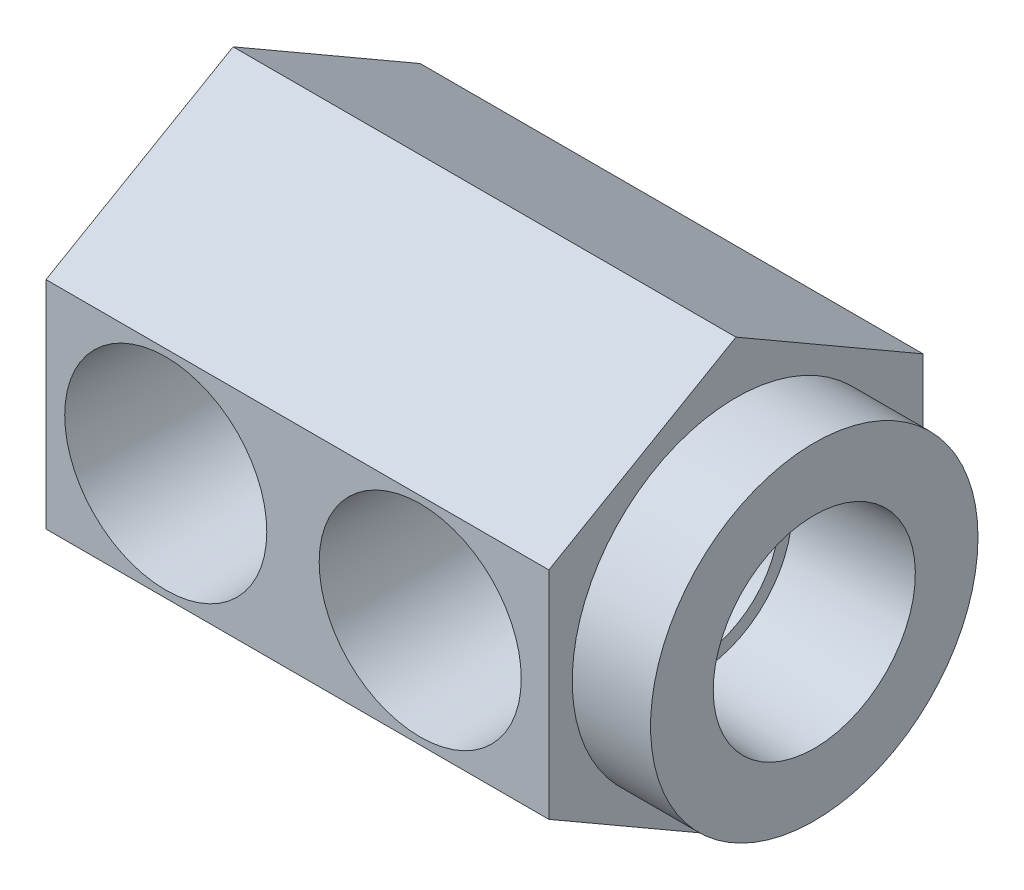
SolidWorks part; units mm, degrees
ref_plane "Front Plane" through (0, 0, 0) normal (0, 0, 1) x (1, 0, 0)
ref_plane "Top Plane" through (0, 0, 0) normal (0, 1, 0) x (1, 0, 0)
ref_plane "Right Plane" through (0, 0, 0) normal (1, 0, 0) x (0, 0, -1)
sketch "Sketch2" plane through (0, 0, 0) normal (1, 0, 0) x (0, 0, -1)
  line L0 (0, 16.1312) -> (0, -16.1312) construction
  line L1 (-12.7, -7.3323) -> (0, -14.6647)
  line L2 (0, -14.6647) -> (12.7, -7.3323)
  line L3 (12.7, -7.3323) -> (12.7, 7.3323)
  line L4 (12.7, 7.3323) -> (0, 14.6647)
  line L5 (0, 14.6647) -> (-12.7, 7.3323)
  line L6 (-12.7, 7.3323) -> (-12.7, -7.3323)
  circle A0 centre (0, 0) radius 12.7 construction
  dimension "D1" = 25.4
extrude "Boss-Extrude1" add sketch "Sketch2" along normal blind 34.1313 separate body
sketch "Sketch3" plane through (34.1313, 0, 0) normal (1, 0, 0) x (0, 0, -1)
  circle A1 centre (0, 0) radius 11.1125
  dimension "D1" = 22.225
extrude "Boss-Extrude2" add sketch "Sketch3" along normal blind 5.3162
sketch "Sketch4" plane through (0, 0, 0) normal (0, 1, 0) x (1, 0, 0)
  line L1 (39.4475, 6.8593) -> (31.51, 6.4433)
  line L3 (31.51, 5.5562) -> (31.51, 6.4433)
  line L5 (39.4475, 0) -> (39.4475, 6.8593)
  line L6 (-12.2162, 0) -> (49987.7838, 0) construction
  line L7 (29.9225, 5.5562) -> (31.51, 5.5562)
  line L8 (29.9225, 5.5562) -> (29.9225, 0)
  line L9 (29.9225, 0) -> (39.4475, 0)
  line L10 (39.4475, -11.1125) -> (39.4475, 11.1125) construction
  dimension "D1" = 11.1125
  dimension "D2" = 3
  dimension "D3" = 7.9375
  dimension "D4" = 9.525
  dimension "D5" = 13.7185
revolve "Cut-Revolve1" cut sketch "Sketch4" angle 360 about L6
hole_wizard "1/4 NPT Tapped Hole1" positions "Sketch6" profile "Sketch5" size "1/4" standard "Ansi Inch"
sketch "Sketch6" plane through (0, 0, -12.7) normal (0, 0, -1) x (-1, 0, 0)
  line L0 (13.97, 0) -> (-13.97, 0) construction
  line L1 (0, 13.97) -> (0, -13.97) construction
  point P0 (-8.128, 0)
  dimension "D1" = 8.128
sketch "Sketch5" plane through (8.128, 0, -12.7) normal (1, 0, 0) x (0, 1, 0)
  line L0 (0, 0) -> (0, 20.4111)
  line L1 (5.5626, 17.0688) -> (0, 20.4111)
  line L2 (-5.5626, 17.0688) -> (0, 20.4111) construction
  line L3 (5.5626, 17.0688) -> (5.5626, 10.0203)
  line L4 (5.5626, 10.0203) -> (6.558, 10.0203)
  line L5 (6.558, 10.0203) -> (6.858, 0)
  line L6 (-6.558, 10.0203) -> (-6.858, 0) construction
  line L7 (6.858, 0) -> (0, 0)
  line L8 (0, -6.35) -> (0, 107.95) construction
  line L11 (-5.5626, 10.0203) -> (-6.558, 10.0203) construction
  dimension "Tap Drill Dia." = 11.1252
  dimension "Tap Drill Depth" = 17.0688
  dimension "Thread Dia." = 13.716
  dimension "Thread Angle" = 3.43
  dimension "Thread Depth" = 10.0203
  dimension "Drill Angle" = 118
hole_wizard "1/4 NPT Tapped Hole2" positions "Sketch8" profile "Sketch7" size "1/4" standard "Ansi Inch"
sketch "Sketch8" plane through (0, 0, 12.7) normal (0, 0, 1) x (1, 0, 0)
  line L0 (0, -13.97) -> (0, 13.97) construction
  circle A0 centre (8.128, 0) radius 6.858 construction
  point P0 (8.128, 0)
  point P1 (25.4, 0)
  dimension "D1" = 25.4
sketch "Sketch7" plane through (8.128, 0, 12.7) normal (1, 0, 0) x (0, -1, 0)
  line L0 (0, 0) -> (0, 20.4111)
  line L1 (5.5626, 17.0688) -> (0, 20.4111)
  line L2 (-5.5626, 17.0688) -> (0, 20.4111) construction
  line L3 (5.5626, 17.0688) -> (5.5626, 10.0203)
  line L4 (5.5626, 10.0203) -> (6.558, 10.0203)
  line L5 (6.558, 10.0203) -> (6.858, 0)
  line L6 (-6.558, 10.0203) -> (-6.858, 0) construction
  line L7 (6.858, 0) -> (0, 0)
  line L8 (0, -6.35) -> (0, 107.95) construction
  line L11 (-5.5626, 10.0203) -> (-6.558, 10.0203) construction
  dimension "Tap Drill Dia." = 11.1252
  dimension "Tap Drill Depth" = 17.0688
  dimension "Thread Dia." = 13.716
  dimension "Thread Angle" = 3.43
  dimension "Thread Depth" = 10.0203
  dimension "Drill Angle" = 118
hole_wizard "7/32 (0.21875) Diameter Hole1" positions "Sketch10" profile "Sketch9" hole size "7/32" standard "Ansi Inch"
sketch "Sketch10" plane through (39.4475, 0, 0) normal (1, 0, 0) x (0, 0, -1)
  circle A0 centre (0, 0) radius 6.8593 construction
  point P0 (0, 0)
sketch "Sketch9" plane through (39.4475, 0, 0) normal (0, 1, 0) x (0, 0, -1)
  line L0 (0, 0) -> (0, 33.4193)
  line L1 (0, 33.4193) -> (2.7781, 31.75)
  line L2 (2.7781, 31.75) -> (2.7781, 0)
  line L5 (2.7781, 0) -> (0, 0)
  line L10 (0, 33.4193) -> (-2.7781, 31.75) construction
  line L11 (0, -6.35) -> (0, 107.95) construction
  dimension "Hole Dia." = 5.5562
  dimension "Hole Depth" = 31.75
  dimension "Drill Angle" = 118
hole_wizard "1/4 (0.25) Diameter Hole1" positions "Sketch12" profile "Sketch11" hole size "1/4" standard "Ansi Inch"
sketch "Sketch12" plane through (39.4475, 0, 0) normal (1, 0, 0) x (0, 0, -1)
  circle A0 centre (0, 0) radius 6.8593 construction
  point P0 (0, 0)
sketch "Sketch11" plane through (39.4475, 0, 0) normal (0, 1, 0) x (0, 0, -1)
  line L0 (0, 0) -> (0, 24.1327)
  line L1 (0, 24.1327) -> (3.175, 22.225)
  line L2 (3.175, 22.225) -> (3.175, 0)
  line L5 (3.175, 0) -> (0, 0)
  line L10 (0, 24.1327) -> (-3.175, 22.225) construction
  line L11 (0, -6.35) -> (0, 107.95) construction
  dimension "Hole Dia." = 6.35
  dimension "Hole Depth" = 22.225
  dimension "Drill Angle" = 118
